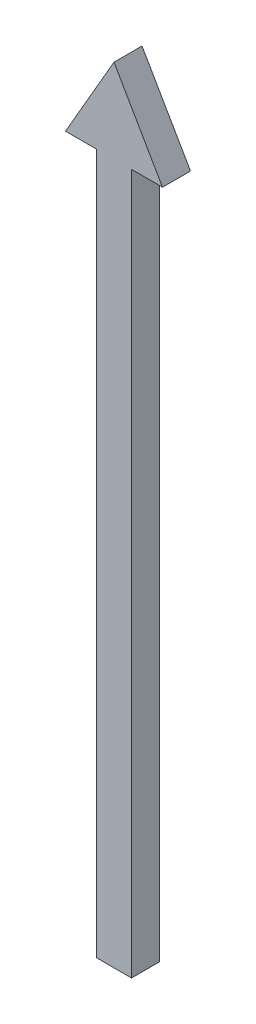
SolidWorks part; units mm, degrees
ref_plane "Face" through (0, 0, 0) normal (0, 0, 1) x (1, 0, 0)
ref_plane "Dessus" through (0, 0, 0) normal (0, 1, 0) x (1, 0, 0)
ref_plane "Droite" through (0, 0, 0) normal (1, 0, 0) x (0, 0, -1)
sketch "Esquisse1" plane through (0, 0, 0) normal (0, 0, 1) x (1, 0, 0)
  line L0 (0, 0) -> (0, 438.611) construction
  line L1 (2.5, 270) -> (6.9282, 270)
  line L2 (-2.5, 170) -> (2.5, 170)
  line L3 (-2.5, 170) -> (-2.5, 270)
  line L4 (6.9282, 270) -> (0, 282)
  line L5 (2.5, 170) -> (2.5, 270)
  line L6 (0, 282) -> (-6.9282, 270)
  line L7 (-6.9282, 270) -> (-2.5, 270)
  dimension "D1" = 100
  dimension "D2" = 170
  dimension "D3" = 5
  dimension "D4" = 30
  dimension "D5" = 30
  dimension "D6" = 12
extrude "Boss.-Extru.1" add sketch "Esquisse1" along normal mid plane 4
